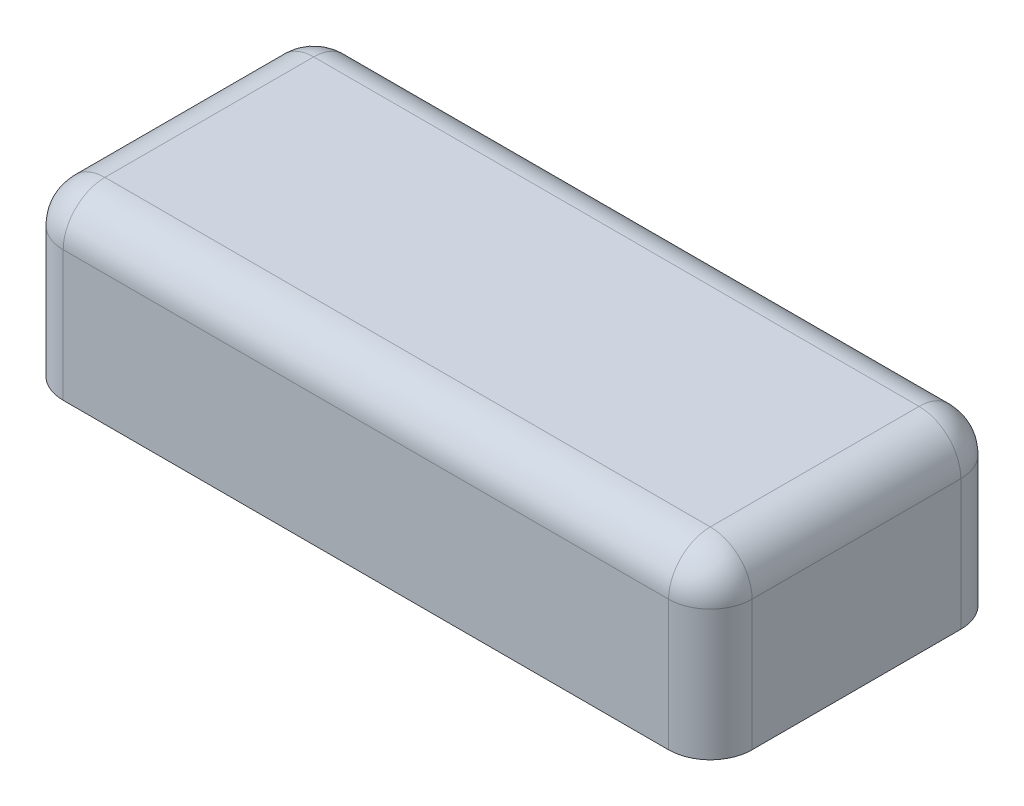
SolidWorks part; units mm, degrees
ref_plane "Front Plane" through (0, 0, 0) normal (0, 0, 1) x (1, 0, 0)
ref_plane "Top Plane" through (0, 0, 0) normal (0, 1, 0) x (1, 0, 0)
ref_plane "Right Plane" through (0, 0, 0) normal (1, 0, 0) x (0, 0, -1)
sketch "Sketch1" plane through (0, 0, 0) normal (0, 1, 0) x (1, 0, 0)
  line L0 (0, -14) -> (0, 14) construction
  line L1 (-33, -14) -> (33, -14)
  line L2 (-33, -14) -> (-33, 14)
  line L3 (-33, 14) -> (33, 14)
  line L4 (33, -14) -> (33, 14)
  line L5 (-33, -14) -> (33, 14) construction
  line L6 (-33, 14) -> (33, -14) construction
  line L7 (-33, 0) -> (33, 0) construction
  circle A0 centre (-29, 10) radius 2
  circle A1 centre (29, 10) radius 2
  circle A2 centre (29, -10) radius 2
  circle A3 centre (-29, -10) radius 2
  point P0 (0, 0)
  point P11 (0, 0)
  point P14 (0, 0)
  dimension "D3" = 4
  dimension "D1" = 66
  dimension "D2" = 28
  dimension "D4" = 4
  dimension "D5" = 4
extrude "Boss-Extrude1" add sketch "Sketch1" along normal blind 5
sketch "Sketch4" plane through (0, 5, 0) normal (0, 1, 0) x (1, 0, 0)
  line L8 (33, -14) -> (33, 14)
  line L9 (33, 14) -> (-33, 14)
  line L10 (-33, 14) -> (-33, -14)
  line L11 (-33, -14) -> (33, -14)
  line L12 (33, -14) -> (33, 14)
  line L13 (33, 14) -> (-33, 14)
  line L14 (-33, 14) -> (-33, -14)
  line L15 (-33, -14) -> (33, -14)
  dimension "D1" = 0
extrude "Boss-Extrude3" add sketch "Sketch4" along normal blind 1
sketch "Sketch5" plane through (0, 6, 0) normal (0, 1, 0) x (1, 0, 0)
  line L5 (-31.5, -12.5) -> (31.5, -12.5)
  line L6 (-31.5, -12.5) -> (-31.5, 12.5)
  line L7 (-31.5, 12.5) -> (31.5, 12.5)
  line L8 (-33, -14) -> (33, -14)
  line L9 (33, -14) -> (33, 14)
  line L10 (33, 14) -> (-33, 14)
  line L11 (-33, 14) -> (-33, -14)
  line L12 (-33, -14) -> (33, -14)
  line L13 (33, -14) -> (33, 14)
  line L14 (33, 14) -> (-33, 14)
  line L15 (-33, 14) -> (-33, -14)
  line L16 (31.5, -12.5) -> (31.5, 12.5)
  line L17 (-31.5, -12.5) -> (31.5, 12.5) construction
  line L18 (-31.5, 12.5) -> (31.5, -12.5) construction
  point P0 (0, 0)
  dimension "D2" = 1.5
  dimension "D3" = 1.5
  dimension "D1" = 0
extrude "Boss-Extrude4" add sketch "Sketch5" along normal blind 9
sketch "Sketch6" plane through (0, 15, 0) normal (0, 1, 0) x (1, 0, 0)
  line L8 (-33, 14) -> (-33, -14)
  line L9 (-33, -14) -> (33, -14)
  line L10 (33, -14) -> (33, 14)
  line L11 (33, 14) -> (-33, 14)
  line L12 (-33, 14) -> (-33, -14)
  line L13 (-33, -14) -> (33, -14)
  line L14 (33, -14) -> (33, 14)
  line L15 (33, 14) -> (-33, 14)
  dimension "D1" = 0
extrude "Boss-Extrude5" add sketch "Sketch6" along normal blind 1.5
sketch "Sketch7" plane through (0, 0, 0) normal (0, -1, 0) x (1, 0, 0)
  line L0 (-25.5, 12.5) -> (25.5, 12.5)
  line L1 (25.5, 12.5) -> (25.5, 10)
  line L2 (-33, 14) -> (33, 14) construction
  line L3 (29, 6.5) -> (31.5, 6.5)
  line L4 (31.5, 6.5) -> (31.5, 0)
  line L5 (33, 14) -> (33, -14) construction
  line L6 (25.5, -12.5) -> (-25.5, -12.5)
  line L7 (-25.5, -12.5) -> (-25.5, -10)
  line L8 (-29, -6.5) -> (-31.5, -6.5)
  line L9 (-31.5, -6.5) -> (-31.5, 0)
  line L10 (0, -12.5) -> (0, 12.5) construction
  line L11 (25.5, -12.5) -> (25.5, -10)
  line L12 (29, -6.5) -> (31.5, -6.5)
  line L13 (31.5, -6.5) -> (31.5, 0)
  line L14 (-31.5, 6.5) -> (-31.5, 0)
  line L15 (-29, 6.5) -> (-31.5, 6.5)
  line L16 (-25.5, 12.5) -> (-25.5, 10)
  arc A0 (25.5, 10) -> (29, 6.5) centre (29, 10) ccw
  circle A1 centre (29, 10) radius 2 construction
  arc A2 (-25.5, -10) -> (-29, -6.5) centre (-29, -10) ccw
  arc A3 (25.5, -10) -> (29, -6.5) centre (29, -10) cw
  arc A4 (-25.5, 10) -> (-29, 6.5) centre (-29, 10) cw
  point P23 (0, 0)
  point P24 (0, 0)
  dimension "D2" = 1.5
  dimension "D1" = 1.5
  dimension "D3" = 1.5
  dimension "D4" = 2
extrude "Cut-Extrude1" cut sketch "Sketch7" against normal up to next
fillet "Fillet2" radius 4 12 edges at (33, 16.5, 0) (0, 16.5, 14) (-33, 16.5, 0) (0, 16.5, -14) (-31.5, 15, 0) (0, 15, 12.5) (31.5, 15, 0) (0, 15, -12.5) (-33, 8.25, -14) (-33, 8.25, 14) (33, 8.25, 14) (33, 8.25, -14)
